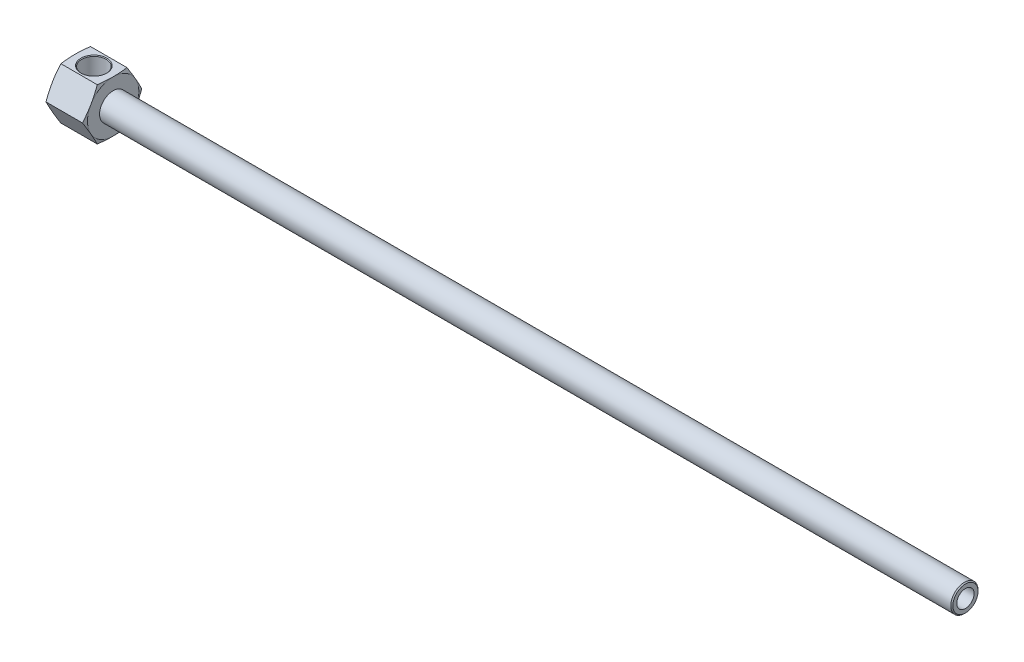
SolidWorks part; units mm, degrees
ref_plane "Front Plane" through (0, 0, 0) normal (0, 0, 1) x (1, 0, 0)
ref_plane "Top Plane" through (0, 0, 0) normal (0, 1, 0) x (1, 0, 0)
ref_plane "Right Plane" through (0, 0, 0) normal (1, 0, 0) x (0, 0, -1)
imported_body "Imported1"
sketch "Sketch1" plane through (14.29, 0, 0) normal (1, 0, 0) x (0, 0, -1)
  circle A0 centre (0, 0) radius 5.0419
  circle A1 centre (0, 0) radius 5.0419 construction
  circle A2 centre (0, 0) radius 3.2029 construction
  circle A3 centre (0, 0) radius 3.2029
extrude "Extrude1" add sketch "Sketch1" along normal offset from surface (315.91 mm away) 330.2
chamfer "Chamfer1" distance 0.381 angle 45 1 edges at (330.2, 0, 5.0419)
